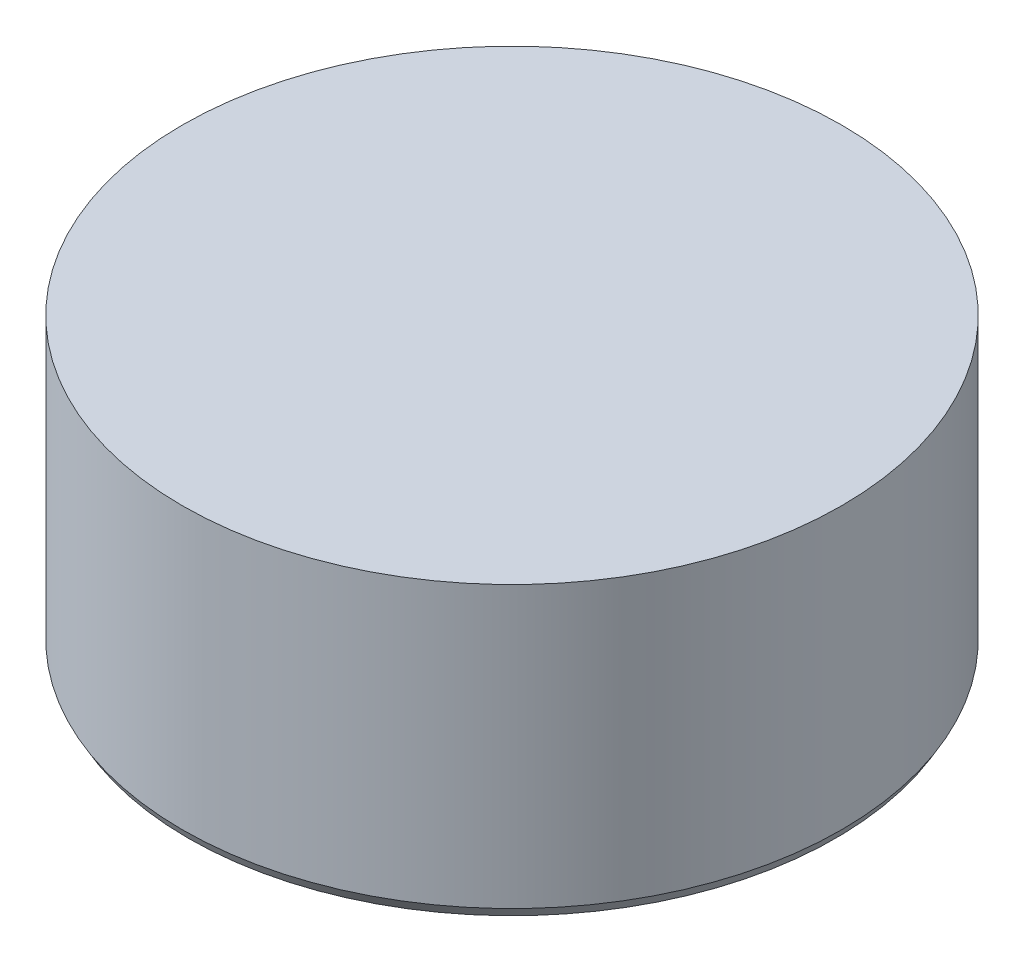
SolidWorks part; units mm, degrees
ref_plane "Front Plane" through (0, 0, 0) normal (0, 0, 1) x (1, 0, 0)
ref_plane "Top Plane" through (0, 0, 0) normal (0, 1, 0) x (1, 0, 0)
ref_plane "Right Plane" through (0, 0, 0) normal (1, 0, 0) x (0, 0, -1)
sketch "Sketch1" plane through (0, 0, 0) normal (0, 0, 1) x (1, 0, 0)
  line L0 (0, 0) -> (0, 27.1606) construction
  line L1 (0, -0.381) -> (0, -1.905)
  line L3 (-3.5814, 0) -> (-3.5814, -1.905)
  line L4 (0, -1.905) -> (-3.5814, -1.905)
  spline S0 degree 3 poles (-3.5814, 0) (-3.4541, -0.3356) (-3.4517, -0.3878) (0, -0.381) knots 0 0 0 0 0.524614 0.524614 0.524614 0.524614
  dimension "D1" = 1.905
  dimension "D2" = 7.1628
  dimension "D3" = 0.381
revolve "Revolve1" add sketch "Sketch1" angle 360 about L0
mirror "Mirror1" of "Revolve1"
sketch "Sketch2" plane through (0, 0, 0) normal (0, 0, 1) x (1, 0, 0)
  line L0 (0, 0) -> (0, 0.595) construction
  line L1 (-3.5814, 0) -> (-3.5814, -3.81) construction
  line L2 (0, 0) -> (-3.5814, 0)
  line L3 (0, 0) -> (0, -0.508)
  line L4 (0, -0.508) -> (-3.5814, -0.508)
  line L5 (-3.5814, 0) -> (-3.5814, -0.508)
  line L6 (-3.5814, -3.81) -> (-3.5814, -3.556)
  line L7 (-3.5814, -3.556) -> (-3.4348, -3.81)
  line L8 (3.5814, -3.81) -> (-3.5814, -3.81) construction
  line L9 (-3.4348, -3.81) -> (-3.5814, -3.81)
  dimension "D1" = 30
  dimension "D2" = 0.254
  dimension "D3" = 0.508
revolve "Cut-Revolve1" cut sketch "Sketch2" angle 360 about L0
